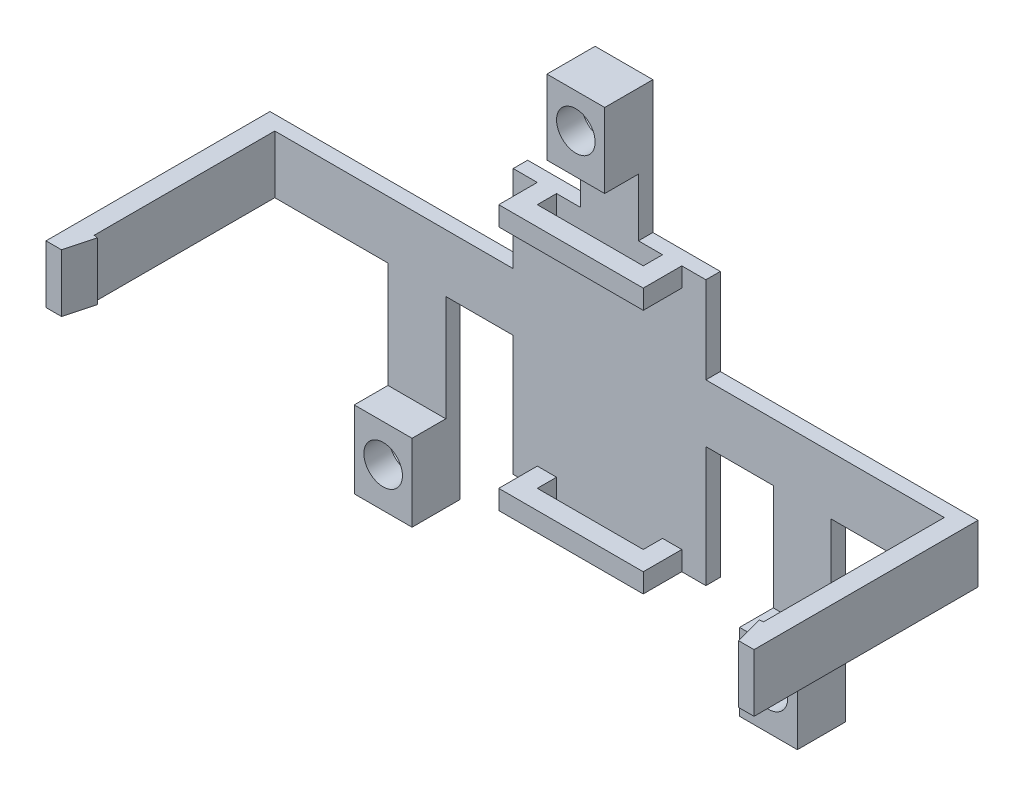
SolidWorks part; units mm, degrees
ref_plane "Front Plane" through (0, 0, 0) normal (0, 0, 1) x (1, 0, 0)
ref_plane "Top Plane" through (0, 0, 0) normal (0, 1, 0) x (1, 0, 0)
ref_plane "Right Plane" through (0, 0, 0) normal (1, 0, 0) x (0, 0, -1)
sketch "Sketch1" plane through (0, 0, 0) normal (0, 0, 1) x (1, 0, 0)
  line L0 (0, 30) -> (0, 48)
  line L2 (0, 0) -> (0, 18)
  line L11 (0, 18) -> (-14, 18)
  line L14 (-53.5, 30) -> (-53.5, 18)
  line L23 (20, 48) -> (20, 7) construction
  line L33 (0, 48) -> (40, 48)
  line L34 (40, 0) -> (40, 18)
  line L42 (40, 30) -> (40, 48)
  line L45 (0, 0) -> (0, -7)
  line L46 (0, -7) -> (40, -7)
  line L47 (40, 0) -> (40, -7)
  line L48 (40, 18) -> (54, 18)
  line L50 (40, 30) -> (93.5, 30)
  line L51 (93.5, 18) -> (93.5, 30)
  line L52 (-26, -4) -> (-14, -4)
  line L53 (-26, -4) -> (-26, 18)
  line L55 (-14, -4) -> (-14, 18)
  line L57 (-26, 18) -> (-53.5, 18)
  line L59 (-53.5, 30) -> (0, 30)
  line L60 (66, 18) -> (93.5, 18)
  line L62 (54, 18) -> (54, -4)
  line L63 (54, -4) -> (66, -4)
  line L64 (66, 18) -> (66, -4)
  dimension "D2" = 48
  dimension "D3" = 12
  dimension "D4" = 20
  dimension "D5" = 18
  dimension "D6" = 53.5
  dimension "D7" = 7
  dimension "D8" = 12
  dimension "D9" = 14
  dimension "D10" = 22
  dimension "D11" = 53.5
  dimension "D12" = 14
  dimension "D13" = 12
  dimension "D14" = 73.5
extrude "Boss-Extrude1" add sketch "Sketch1" along normal blind 3
sketch "Sketch5" plane through (0, -7, 0) normal (0, -1, 0) x (1, 0, 0)
  line L0 (5, 3) -> (5, 11)
  line L1 (0, 3) -> (40, 3) construction
  line L2 (5, 11) -> (35, 11)
  line L3 (35, 11) -> (35, 3)
  line L4 (35, 3) -> (31, 3)
  line L5 (31, 3) -> (31, 7)
  line L6 (31, 7) -> (9, 7)
  line L7 (9, 7) -> (9, 3)
  line L8 (9, 3) -> (5, 3)
  dimension "D1" = 30
  dimension "D2" = 5
  dimension "D3" = 4
  dimension "D4" = 4
  dimension "D5" = 4
  dimension "D6" = 8
extrude "Boss-Extrude2" add sketch "Sketch5" against normal blind 4
sketch "Sketch6" plane through (0, 48, 0) normal (0, 1, 0) x (1, 0, 0)
  line L1 (5, -3) -> (9, -3)
  line L2 (5, -3) -> (5, -11)
  line L4 (9, -3) -> (9, -7)
  line L5 (5, -11) -> (35, -11)
  line L7 (35, -11) -> (35, -3)
  line L8 (35, -3) -> (31, -3)
  line L9 (31, -7) -> (31, -3)
  line L12 (9, -7) -> (31, -7)
  dimension "D1" = 4
  dimension "D2" = 4
extrude "Boss-Extrude3" add sketch "Sketch6" against normal blind 4
sketch "Sketch8" plane through (0, 0, 0) normal (0, 0, -1) x (-1, 0, 0)
  line L1 (-66, -4) -> (-54, -4)
  line L2 (-66, -4) -> (-66, -20)
  line L3 (-66, -20) -> (-54, -20)
  line L4 (-54, -4) -> (-54, -20)
  line L5 (14, -4) -> (26, -4)
  line L6 (14, -4) -> (14, -20)
  line L7 (14, -20) -> (26, -20)
  line L8 (26, -4) -> (26, -20)
  dimension "D1" = 12
  dimension "D2" = 12
  dimension "D3" = 16
  dimension "D4" = 16
extrude "Boss-Extrude5" add sketch "Sketch8" against normal blind 10
sketch "Sketch9" plane through (0, 0, 10) normal (0, 0, 1) x (1, 0, 0)
  line L0 (-26, -20) -> (-26, -4) construction
  line L1 (-14, -20) -> (-26, -20) construction
  line L2 (20, 48) -> (20, -7) construction
  line L3 (5, 48) -> (35, 48) construction
  line L4 (35, -7) -> (5, -7) construction
  circle A0 centre (-20, -11.74) radius 3
  circle A1 centre (60, -11.74) radius 3
  dimension "D1" = 6
  dimension "D2" = 6
  dimension "D3" = 8.26
extrude "Cut-Extrude1" cut sketch "Sketch9" against normal through all
sketch "Sketch10" plane through (0, 0, 0) normal (0, 0, -1) x (-1, 0, 0)
  line L0 (-40, 48) -> (0, 48) construction
  line L1 (-26, 48) -> (-14, 48)
  line L2 (-26, 48) -> (-26, 60)
  line L3 (-26, 60) -> (-14, 60)
  line L4 (-14, 48) -> (-14, 60)
  line L5 (-40, 30) -> (-40, 48) construction
  dimension "D1" = 12
  dimension "D2" = 14
  dimension "D3" = 12
extrude "Boss-Extrude6" add sketch "Sketch10" against normal blind 3
sketch "Sketch11" plane through (0, 0, 0) normal (0, 0, -1) x (-1, 0, 0)
  line L1 (-26, 60) -> (-14, 60)
  line L2 (-26, 60) -> (-26, 75.48)
  line L3 (-26, 75.48) -> (-14, 75.48)
  line L4 (-14, 60) -> (-14, 75.48)
  dimension "D1" = 12
  dimension "D2" = 15.48
extrude "Boss-Extrude7" add sketch "Sketch11" against normal blind 10
sketch "Sketch12" plane through (0, 0, 10) normal (0, 0, 1) x (1, 0, 0)
  line L0 (14, 75.48) -> (26, 75.48) construction
  line L1 (14, 60) -> (14, 75.48) construction
  circle A0 centre (20, 68.26) radius 3
  dimension "D1" = 6
  dimension "D2" = 7.22
  dimension "D3" = 6
extrude "Cut-Extrude2" cut sketch "Sketch12" against normal blind 10
sketch "Sketch13" plane through (0, 0, 10) normal (0, 0, 1) x (1, 0, 0)
  circle A0 centre (20, 68.26) radius 4
  circle A1 centre (60, -11.74) radius 4
  circle A2 centre (-20, -11.74) radius 4
  dimension "D1" = 8
extrude "Cut-Extrude3" cut sketch "Sketch13" against normal blind 5.3
chamfer "Chamfer1" distance 1 angle 45 3 edges at (23, 68.26, 4.7) (63, -11.74, 4.7) (-17, -11.74, 4.7)
sketch "Sketch14" plane through (0, 0, 3) normal (0, 0, 1) x (1, 0, 0)
  line L1 (-26, 18) -> (-53.5, 18)
  line L2 (-26, 18) -> (-26, 30)
  line L3 (-26, 30) -> (-53.5, 30)
  line L4 (-53.5, 18) -> (-53.5, 30)
extrude "Cut-Extrude4" [suppressed] cut sketch "Sketch14" against normal blind 10
ref_plane "Plane1" through (20, 0, 0) normal (1, 0, 0) x (0, 0, -1)
sketch "Sketch16" plane through (0, 0, 3) normal (0, 0, 1) x (1, 0, 0)
  line L0 (93.5, 18) -> (93.5, 30) construction
  line L1 (93.5, 18) -> (93.5, 30)
extrude "Extrude-Thin2" add sketch "Sketch16" along normal blind 37.5 thin
sketch "Sketch17" plane through (0, 18, 0) normal (0, -1, 0) x (1, 0, 0)
  line L0 (93.5, 40.5) -> (93.5, 46.5)
  line L1 (89.5, 40.5) -> (88.7, 40.6411)
  line L2 (88.7, 40.6411) -> (90.2699, 46.5)
  line L3 (90.2699, 46.5) -> (93.5, 46.5)
  line L4 (93.5, 40.5) -> (89.5, 40.5) construction
  line L11 (66, 0) -> (93.5, 0)
  line L12 (93.5, 0) -> (93.5, 40.5)
  line L13 (93.5, 40.5) -> (89.5, 40.5)
  line L14 (89.5, 40.5) -> (89.5, 3)
  line L15 (89.5, 3) -> (66, 3)
  line L16 (66, 3) -> (66, 0)
  line L19 (93.5, 40.5) -> (89.5, 40.5)
  dimension "D1" = 10
  dimension "D2" = 0.8
  dimension "D3" = 6
  dimension "D4" = 15
  dimension "D5" = 0
extrude "Boss-Extrude8" add sketch "Sketch17" against normal up to surface (12 mm away)
mirror "Mirror1" about plane through (20, 0, 0) normal (1, 0, 0) of "Boss-Extrude8", "Extrude-Thin2"
